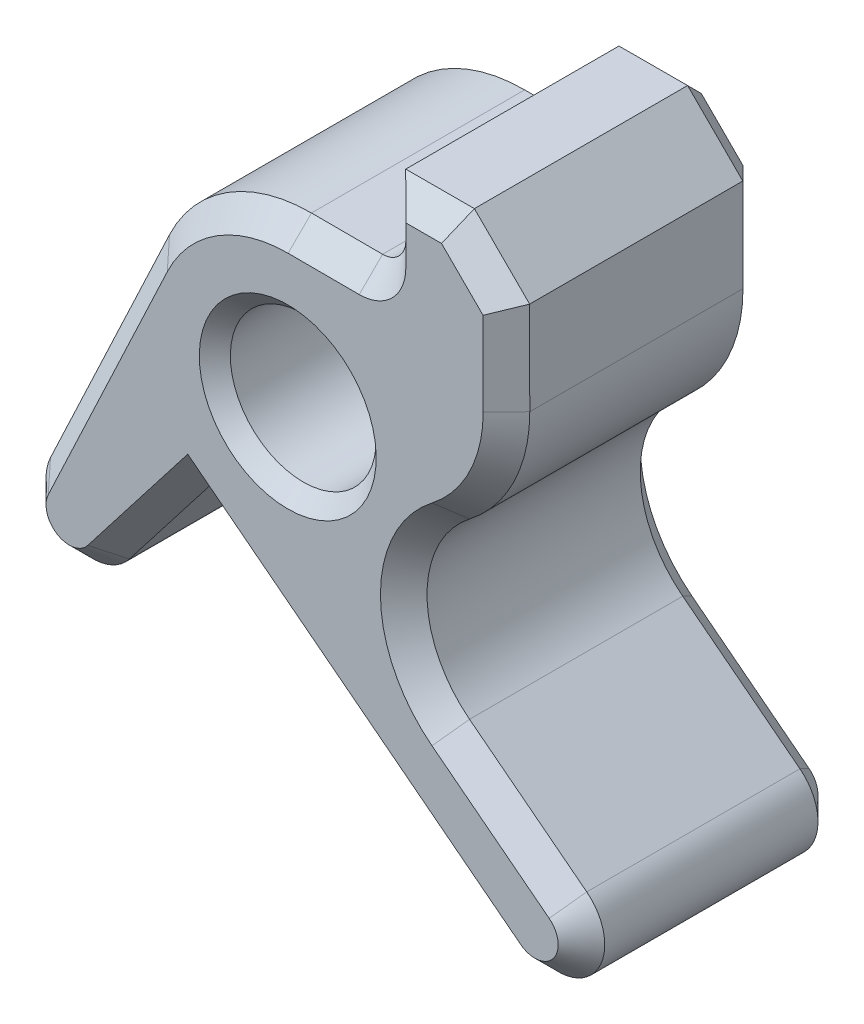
SolidWorks part; units mm, degrees
ref_plane "Front Plane" through (0, 0, 0) normal (0, 0, 1) x (1, 0, 0)
ref_plane "Top Plane" through (0, 0, 0) normal (0, 1, 0) x (1, 0, 0)
ref_plane "Right Plane" through (0, 0, 0) normal (1, 0, 0) x (0, 0, -1)
sketch "Sketch1" plane through (0, 0, 0) normal (0, 1, 0) x (1, 0, 0)
  line L0 (0, 0) -> (0, -3.81) construction
  line L1 (0, -3.81) -> (0, -9.906) construction
  line L5 (0, -3.81) -> (141.5288, -3.81)
  line L6 (141.5288, -34.1262) -> (-36.2712, -34.1262)
  line L7 (-36.2712, -34.1262) -> (-36.2712, -22.86)
  line L8 (0, -3.81) -> (-17.2212, -3.81)
  line L9 (-36.2712, -34.1262) -> (-36.2712, -5.447)
  line L10 (-36.2712, -5.447) -> (141.5288, -5.447)
  line L11 (-36.2712, -7.352) -> (141.5288, -7.352)
  line L12 (-36.2712, -9.892) -> (3.8608, -9.892)
  line L13 (-6.4262, 27.9146) -> (-6.4262, 12.192)
  line L14 (-6.4262, 27.9146) -> (58.5978, 27.9146)
  line L15 (58.5978, 27.9146) -> (58.5978, -3.81)
  line L16 (-6.4262, 12.192) -> (-30.607, 12.192)
  line L17 (-30.607, 12.192) -> (-30.607, -3.81)
  circle A0 centre (0, 0) radius 2.8575
  circle A5 centre (0, 14.3256) radius 4.7752
  circle A6 centre (28.575, 20.0406) radius 1.9812
  circle A7 centre (49.9872, 12.065) radius 1.9812
  circle A8 centre (141.5288, 2.54) radius 3.1877
  arc A9 (-36.2712, -22.86) -> (-17.2212, -3.81) centre (-17.2212, -22.86) cw
  circle A10 centre (-20.3962, 2.54) radius 3.1877
  point P8 (0, -3.81)
  point P27 (-36.2712, -19.7866)
  dimension "D1" = 5.715
  dimension "D4" = 3.9624
  dimension "D7" = 9.5504
  dimension "D11" = 6.3754
  dimension "D15" = 19.05
  dimension "D2" = 3.81
  dimension "D3" = 6.096
  dimension "D5" = 7.9756
  dimension "D6" = 14.3256
  dimension "D8" = 21.4122
  dimension "D9" = 49.9872
  dimension "D10" = 5.715
  dimension "D12" = 91.5416
  dimension "D13" = 6.35
  dimension "D14" = 177.8
  dimension "D16" = 161.925
  dimension "D17" = 28.6791
  dimension "D18" = 22.3266
  dimension "D19" = 1.905
  dimension "D20" = 2.54
  dimension "D21" = 40.132
  dimension "D22" = 16.002
  dimension "D23" = 82.931
  dimension "D24" = 31.7246
  dimension "D25" = 65.024
  dimension "D26" = 172.1358
sketch "Sketch2" plane through (0, 0, 0) normal (0, 1, 0) x (1, 0, 0)
  line L0 (28.575, 20.0406) -> (-1.7398, 16.8714) construction
  line L1 (28.575, 20.0406) -> (49.1006, 22.1864) construction
  line L2 (0, 9.5504) -> (0, 15.6083) construction
  line L3 (4.5997, 15.6083) -> (-4.5997, 15.6083) construction
  line L4 (-1.7398, 16.8714) -> (-2.4344, 23.5154)
  line L5 (49.1006, 22.1864) -> (48.7705, 25.3442)
  line L6 (-2.4344, 23.5154) -> (48.7705, 25.3442)
  line L7 (49.9872, 20.066) -> (49.9872, 17.9832)
  line L8 (49.9872, 17.9832) -> (49.9872, 12.065) construction
  line L9 (49.9872, 17.9832) -> (44.6029, 17.9832)
  line L10 (6.9057, 16.4983) -> (7.3678, 12.0774)
  line L11 (49.9872, 12.065) -> (58.5978, 12.0523) construction
  line L12 (58.5978, 27.9146) -> (58.5978, -3.81) construction
  line L13 (7.3678, 12.0774) -> (29.1692, 14.3566)
  line L14 (-1.7398, 16.8714) -> (-1.6077, 15.6083)
  line L15 (-1.6077, 15.6083) -> (49.2327, 20.9233)
  line L16 (49.1006, 22.1864) -> (49.2327, 20.9233)
  line L17 (28.575, 20.0406) -> (28.707, 18.7775) construction
  line L18 (28.707, 18.7775) -> (30.2256, 4.2516) construction
  line L19 (6.9987, 15.6083) -> (29.1692, 14.3566)
  line L20 (-20.3962, 2.54) -> (-17.2085, 2.54) construction
  line L21 (-17.2085, 2.54) -> (-14.5415, 2.54) construction
  line L22 (-20.3962, 2.54) -> (-23.5839, 2.54) construction
  line L23 (-23.5839, 2.54) -> (-25.8191, 2.54) construction
  line L24 (-14.5415, 2.54) -> (-13.2715, 2.54) construction
  line L25 (-13.2715, -7.112) -> (-13.2715, 12.192) construction
  line L26 (-6.4262, 12.192) -> (-30.607, 12.192) construction
  circle A0 centre (0, 14.3256) radius 4.7752 construction
  circle A1 centre (49.9872, 12.065) radius 1.9812 construction
  circle A2 centre (28.575, 20.0406) radius 1.9812 construction
  circle A3 centre (0, 14.3256) radius 4.7752 construction
  circle A4 centre (49.9872, 12.065) radius 1.9812 construction
  circle A5 centre (28.575, 20.0406) radius 1.9812 construction
  arc A7 (44.6029, 17.9832) -> (49.9872, 20.066) centre (49.9872, 12.065) ccw
  circle A8 centre (-20.3962, 2.54) radius 3.1877 construction
  point P17 (0, 15.6083)
  point P47 (-13.2715, 2.54)
  dimension "D6" = 16.002
  dimension "D1" = 30.48
  dimension "D2" = 20.6375
  dimension "D3" = 6.0579
  dimension "D4" = 6.6802
  dimension "D5" = 3.175
  dimension "D7" = 2.0828
  dimension "D8" = 1.27
  dimension "D9" = 15.875
  dimension "D10" = 8.5598
  dimension "D11" = 4.445
  dimension "D12" = 2.667
  dimension "D13" = 2.2352
  dimension "D14" = 1.27
sketch "Sketch3" plane through (0, 0, 0) normal (0, 1, 0) x (1, 0, 0)
  line L0 (3.8728, -9.8817) -> (3.8765, -7.3417)
  line L1 (6.9987, 15.6083) -> (29.1692, 14.3566) construction
  line L2 (0, 0) -> (6.4838, 1.2067) construction
  line L3 (0, 0) -> (11.43, 0) construction
  line L5 (8.9401, -7.633) -> (8.9457, -3.823)
  line L6 (6.4818, 8.3025) -> (0, 3.2767) construction
  line L7 (6.9987, 15.6083) -> (13.3487, 15.2498) construction
  line L8 (-3.9213, 5.0574) -> (8.9408, 15.0302)
  line L9 (0, 3.2767) -> (0, 0) construction
  line L10 (2.9254, -6.3917) -> (0.0171, -6.3995)
  line L11 (0.0171, -6.3995) -> (0, 0) construction
  line L12 (0, 0) -> (8.9512, -0.013) construction
  line L13 (11.2754, 12.0192) -> (6.4818, 8.3025)
  line L14 (8.9512, -0.013) -> (8.9457, -3.823) construction
  line L15 (3.8728, -9.8817) -> (6.6808, -9.8858)
  line L16 (6.6808, -9.8858) -> (8.9401, -7.633)
  line L19 (-3.9213, 5.0574) -> (-7.4289, 9.5812)
  line L22 (-10.6575, 7.6017) -> (-5.7888, -2.7284)
  arc A0 (2.9254, -6.3917) -> (3.8765, -7.3417) centre (2.9279, -7.3403) cw
  arc A1 (0.0171, -6.3995) -> (-5.7888, -2.7284) centre (0, 0) cw
  arc A2 (8.9408, 15.0302) -> (11.2754, 12.0192) centre (10.1081, 13.5247) cw
  arc A3 (6.4818, 8.3025) -> (6.4838, 1.2067) centre (9.232, 4.7554) ccw
  arc A4 (6.4838, 1.2067) -> (8.9457, -3.823) centre (2.5957, -3.8138) cw
  arc A6 (-10.6575, 7.6017) -> (-7.4289, 9.5812) centre (-8.9343, 8.4139) cw
  circle A7 centre (0, 0) radius 2.9825
  point P2 (0, 0)
  point P7 (0, 0)
  point P12 (-6.814, 9.8045)
  point P32 (-6.2584, -1.3365)
  point P34 (0, 0)
  point P35 (0, 0)
  point P36 (-8.6183, 9.848)
  point P37 (-6.72, 10.2692)
  point P38 (13.5444, 10.0817)
  dimension "D4" = 6.35
  dimension "D12" = 6.3995
  dimension "D10" = 4.4884
  dimension "D18" = 5.965
  dimension "D20" = 1.905
  dimension "D1" = 11.43
  dimension "D2" = 3.81
  dimension "D3" = 0.9525
  dimension "D5" = 3.81
  dimension "D6" = 6.35
  dimension "D7" = 2.54
  dimension "D8" = 135
  dimension "D9" = 2.9083
  dimension "D11" = 6.0657
  dimension "D13" = 127.789
  dimension "D14" = 3.81
  dimension "D15" = 16.2755
  dimension "D16" = 135
  dimension "D17" = 2.808
  dimension "D19" = 3.1905
  dimension "D21" = 5.7243
extrude "Boss-Extrude1" add sketch "Sketch3" along normal mid plane 10.6252
chamfer "Chamfer1" distance 0.635 angle 45 2 edges at (0, 5.3126, 2.9825) (0, -5.3126, 2.9825)
move or copy body "Body-Move/Copy1" bodies to move or copy 101 copy no rotation origin (0, 0, -2.772) rotation axis (-1, 0, 0) rotation angle 90
chamfer "Chamfer2" distance 0.9525 angle 45 30 edges at (7.8105, 11.5313, -8.0846) (5.2768, 12.6557, -8.0846) (3.8747, 11.3837, -8.0846) (3.5983, 9.4411, -8.0846) (-5.6751, -4.5473, -8.0846) (1.4713, 9.1676, -8.0846) (-9.93, -7.266, -8.0846) (-3.4201, 8.1809, -8.0846) (-8.2232, 0.3353, -8.0846) (2.5097, -7.2718, -8.0846) (8.9429, 8.5, -8.0846) (11.6136, -11.92, -8.0846) (8.2991, 3.7941, -8.0846) (8.8786, -7.3889, -8.0846) (4.7436, -1.9821, -8.0846) (5.2768, 12.6557, 2.5406) (7.8105, 11.5313, 2.5406) (3.8747, 11.3837, 2.5406) (3.5983, 9.4411, 2.5406) (-5.6751, -4.5473, 2.5406) (1.4713, 9.1676, 2.5406) (-9.93, -7.266, 2.5406) (-3.4201, 8.1809, 2.5406) (-8.2232, 0.3353, 2.5406) (2.5097, -7.2718, 2.5406) (11.6136, -11.92, 2.5406) (8.8786, -7.3889, 2.5406) (8.9429, 8.5, 2.5406) (4.7436, -1.9821, 2.5406) (8.2991, 3.7941, 2.5406)
